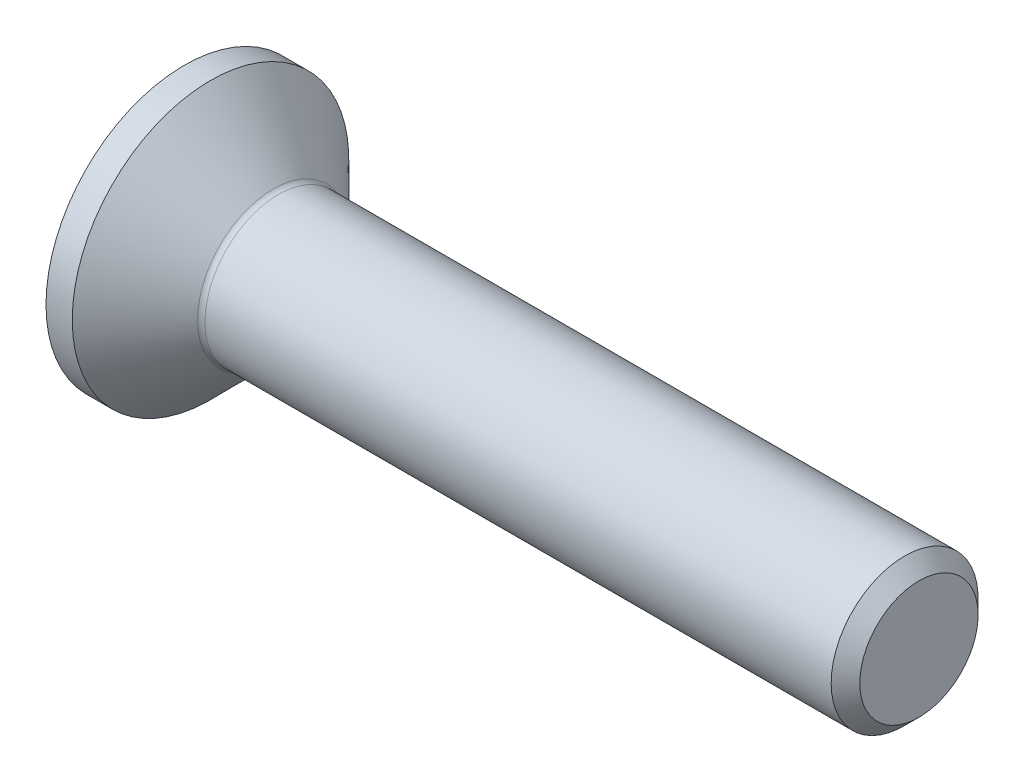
SolidWorks part; units mm, degrees
revolve "PreBroach" cut sketch "Sketch2"
sketch "Sketch2"
  line L0 (0, 1.25) -> (1.5, 1.25)
  line L1 (1.5, 1.25) -> (2.2217, 0)
  line L2 (0, 0) -> (127, 0) construction
  line L3 (2.2217, 0) -> (0, 0)
  line L4 (0, 0) -> (0, 1.25)
  line L5 (0, -1.25) -> (1.5, -1.25) construction
  line L6 (0, 0) -> (47.625, 0) construction
  line L8 (0, 3.765) -> (0, -3.765) construction
revolve "BaseBody" add sketch "BodySke"
sketch "BodySke" plane through (0, 0, 0) normal (0, 0, 1) x (1, 0, 0)
  line L0 (0, 0) -> (0, 3.765)
  line L1 (0.715, 3.765) -> (2.48, 2)
  line L2 (0, 3.765) -> (0.715, 3.765)
  line L3 (2.48, 2) -> (19.61, 2)
  line L4 (20, 1.61) -> (20, 0)
  line L5 (20, 0) -> (0, 0)
  line L6 (0, 0) -> (127, 0) construction
  line L7 (0.715, -3.765) -> (2.48, -2) construction
  line L8 (20, 1.61) -> (19.61, 2)
  line L9 (0, -3.765) -> (0.715, -3.765) construction
  line L10 (20, -1.61) -> (19.61, -2) construction
  line L11 (3.18, 8.35) -> (3.18, -13.875) construction
  line L12 (0, 19.05) -> (0, -3.175) construction
fillet "Fillet1" radius 0.2 1 edges at (2.48, 0, 2)
ref_plane "Plane1" through (0, 0, 0) normal (0, 0, 1) x (1, 0, 0)
ref_plane "Plane2" through (0, 0, 0) normal (0, 1, 0) x (1, 0, 0)
ref_plane "Plane3" through (0, 0, 0) normal (1, 0, 0) x (0, 0, -1)
sketch "Sketch3" plane through (0, 0, 0) normal (-1, 0, 0) x (0, 0, 1)
  line L0 (-1.25, -0.7217) -> (-1.25, 0.7217)
  line L1 (-1.25, 0.7217) -> (0, 1.4434)
  line L2 (0, 1.4434) -> (1.25, 0.7217)
  line L3 (1.25, 0.7217) -> (1.25, -0.7217)
  line L4 (1.25, -0.7217) -> (0, -1.4434)
  line L5 (0, -1.4434) -> (-1.25, -0.7217)
extrude "Hex" cut sketch "Sketch3" against normal blind 1.5
sketch "ThdSchSke" plane through (0, 0, 0) normal (0, 0, 1) x (1, 0, 0)
  line L0 (4.58, -1.61) -> (4.3069, -2)
  line L1 (4.58, -1.61) -> (4.8531, -2)
  line L2 (4.8531, -2) -> (4.8531, -2.5)
  line L3 (-3.175, 0) -> (5.1513, 0) construction
  line L4 (0, 3.765) -> (0, -3.765) construction
  line L5 (4.8531, -2.5) -> (4.3069, -2.5)
  line L6 (4.3069, -2.5) -> (4.3069, -2)
revolve "ThreadSchematic" [suppressed] cut sketch "ThdSchSke" angle 360 about L3
pattern_linear "ThdSchPat" [suppressed]
equation "\"Thread_minor@ThreadCosmetic\"  =  \"Minor_dia@BodySke\""
equation "\"D1@Sketch3\" = \"Hex_size@Sketch3\" / 2"
equation "\"D2@Sketch3\" = \"D1@Sketch3\""
equation "\"D3@Sketch3\" = \"Hex_size@Sketch3\""
equation "\"Thread_length@ThreadCosmetic\" = ((sgn( (\"Length@BodySke\" - \"Advance@BodySke\" * 3.0 - \"Head_ht@BodySke\" ) - \"Thread_nom@BodySke\" )-1)*( (\"Length@BodySke\" - \"Advance@BodySke\" * 3.0 - \"Head_ht@BodySke\" "
equation "\"Thread_minor@ThdSchSke\" = \"Minor_dia@BodySke\""
equation "\"Diameter@ThdSchSke\" = \"Diameter@BodySke\""
equation "\"Overcut@ThdSchSke\" = \"Diameter@BodySke\" * 1.25"
equation "\"Start@ThdSchSke\" = 0.000001 + \"Length@BodySke\" - \"Thread_length@ThreadCosmetic\"  '---Countersunk---"
equation "\"Num_threads@ThdSchPat\" = int( \"Thread_length@ThreadCosmetic\" / \"Advance@BodySke\" + 0.999 )  + 1"
equation "\"Advance@ThdSchPat\" = \"Thread_length@ThreadCosmetic\" /  (\"Num_threads@ThdSchPat\" - 1) 'relax it"
equation "\"Num_threads@ThdSchPat\" = \"Num_threads@ThdSchPat\" - sgn( \"Num_threads@ThdSchPat\" - 1) '---chamfered tips only---"
